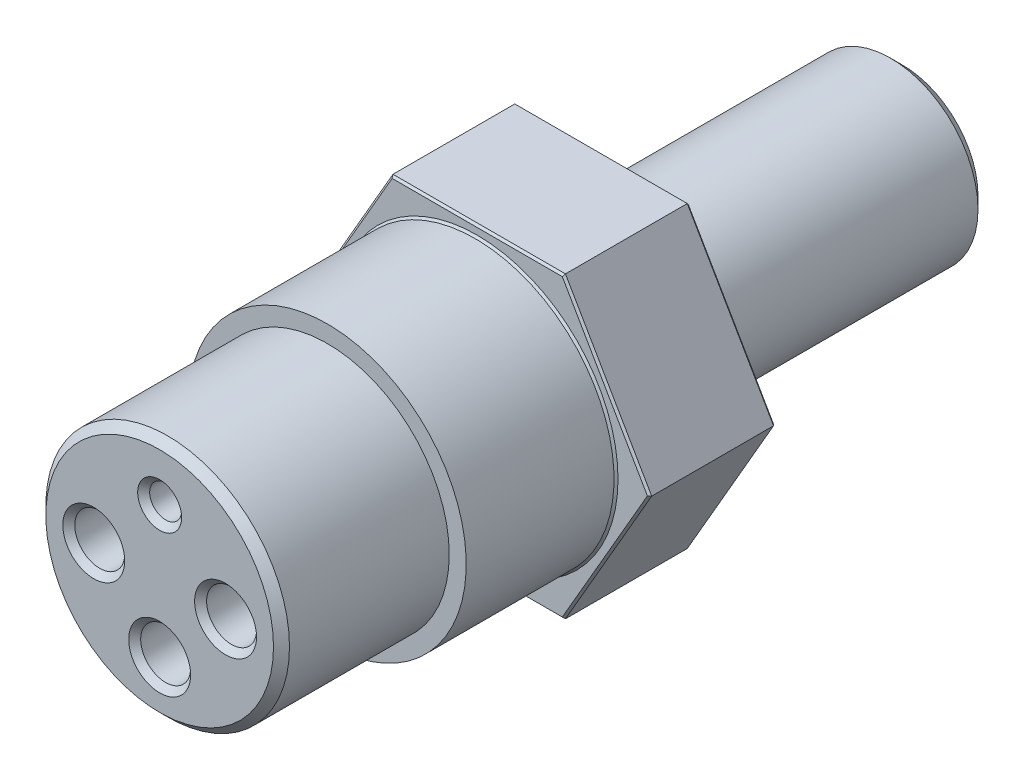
SolidWorks part; units mm, degrees
ref_plane "Front" through (0, 0, 0) normal (0, 0, 1) x (1, 0, 0)
ref_plane "Top" through (0, 0, 0) normal (0, 1, 0) x (1, 0, 0)
ref_plane "Right" through (0, 0, 0) normal (1, 0, 0) x (0, 0, -1)
sketch "Sketch1" plane through (0, 0, 0) normal (0, 0, 1) x (1, 0, 0)
  circle A0 centre (0, 0) radius 5.5562
  dimension "D1" = 11.1125
extrude "post" add sketch "Sketch1" against normal blind 19.05
chamfer "Chamfer1" distance 0.762 angle 45 1 edges at (5.5562, 0, -19.05)
sketch "Sketch2" plane through (0, 0, 0) normal (0, 0, 1) x (1, 0, 0)
  line L1 (-5.4846, 9.4996) -> (-10.9692, 0)
  line L2 (-10.9692, 0) -> (-5.4846, -9.4996)
  line L3 (-5.4846, -9.4996) -> (5.4846, -9.4996)
  line L4 (5.4846, -9.4996) -> (10.9692, 0)
  line L5 (10.9692, 0) -> (5.4846, 9.4996)
  line L6 (5.4846, 9.4996) -> (-5.4846, 9.4996)
  circle A0 centre (0, 0) radius 9.4996 construction
  dimension "D1" = 18.9992
extrude "hex" add sketch "Sketch2" along normal blind 8.001
sketch "Sketch5" plane through (0, 0, 8.001) normal (0, 0, 1) x (1, 0, 0)
  circle A0 centre (0, 0) radius 8.8265
  dimension "D1" = 17.653
extrude "Extrude1" add sketch "Sketch5" along normal blind 9.525
chamfer "Chamfer2" distance 0.127 angle 45 12 edges at (8.2269, 4.7498, 0) (0, 9.4996, 8.001) (-8.2269, 4.7498, 8.001) (-8.2269, -4.7498, 8.001) (0, -9.4996, 8.001) (8.2269, -4.7498, 8.001) (8.2269, 4.7498, 8.001) (-8.8265, 0, 8.001) (0, 9.4996, 0) (-8.2269, -4.7498, 0) (0, -9.4996, 0) (8.2269, -4.7498, 0)
sketch "Sketch3" plane through (0, 0, 17.526) normal (0, 0, 1) x (1, 0, 0)
  circle A0 centre (0, 0) radius 7.747
  dimension "D1" = 15.494
extrude "rubber" add sketch "Sketch3" along normal blind 10.668
chamfer "Chamfer3" distance 0.508 angle 45 1 edges at (7.747, 0, 28.194)
sketch "Sketch4" plane through (0, 0, 28.194) normal (0, 0, 1) x (1, 0, 0)
  line L0 (0, 6.6112) -> (0, -6.1992) construction
  line L3 (0, 0) -> (10.615, 0) construction
  line L4 (0, 0) -> (-9.6911, 0) construction
  line L5 (0, 0) -> (0, -10.7554) construction
  line L6 (0, 0) -> (0, 10.7142) construction
  circle A0 centre (0, 0) radius 4.191 construction
  circle A3 centre (0, -4.191) radius 1.5875
  circle A4 centre (0, 4.191) radius 1.016
  circle A5 centre (-4.191, 0) radius 1.5875
  circle A6 centre (4.191, 0) radius 1.5875
  dimension "D1" = 8.382
  dimension "D2" = 90
  dimension "D3" = 3.175
  dimension "D4" = 3.175
  dimension "D5" = 2.032
  dimension "D6" = 3.175
extrude "sockets" cut sketch "Sketch4" against normal blind 6.35
chamfer "Chamfer4" distance 0.381 angle 45 4 edges at (1.5875, -4.191, 28.194) (5.7785, 0, 28.194) (-2.6035, 0, 28.194) (1.016, 4.191, 28.194)
